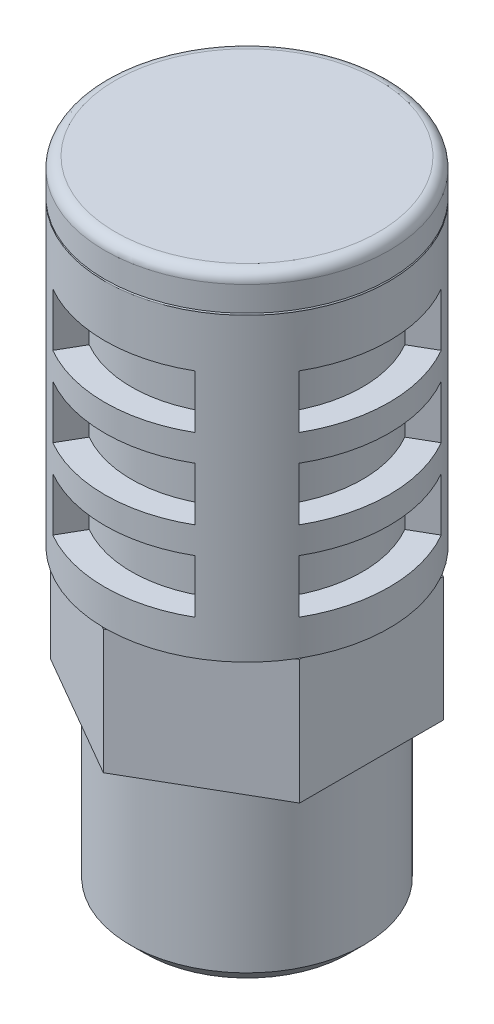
SolidWorks part; units mm, degrees
ref_plane "前视基准面" through (0, 0, 0) normal (0, 0, 1) x (1, 0, 0)
ref_plane "上视基准面" through (0, 0, 0) normal (0, 1, 0) x (1, 0, 0)
ref_plane "右视基准面" through (0, 0, 0) normal (1, 0, 0) x (0, 0, -1)
sketch "草图1" plane through (0, 0, 0) normal (0, 0, 1) x (1, 0, 0)
  line L0 (0, 36) -> (7.4, 36)
  line L1 (8, 35.4) -> (8, 34)
  line L2 (8, 34) -> (7.9, 34)
  line L3 (8, 33.9) -> (8, 17)
  line L4 (8, 17) -> (8.0829, 17)
  line L5 (8.0829, 17) -> (8.0829, 10)
  line L6 (8.0829, 10) -> (6.5785, 10)
  line L7 (6.5785, 10) -> (6.5785, 0.856)
  line L8 (6.5785, 0.856) -> (5.7225, 0)
  line L9 (5.7225, 0) -> (3.2893, 0)
  line L10 (3.2893, 0) -> (3.2893, 31)
  line L11 (3.2893, 31) -> (0, 32.899)
  line L12 (0, 32.899) -> (0, 36)
  line L13 (0, 0) -> (0, 36) construction
  arc A0 (7.4, 36) -> (8, 35.4) centre (7.4, 35.4) cw
  arc A1 (7.9, 34) -> (8, 33.9) centre (7.9, 33.9) cw
revolve "旋转1" add sketch "草图1" angle 360 about L13
sketch "草图2" plane through (0, 0, 0) normal (0, 0, 1) x (1, 0, 0)
  line L0 (6.5, 28) -> (8, 28)
  line L1 (8, 28) -> (8, 26.5)
  line L2 (8, 26.5) -> (6.5, 26.5)
  line L3 (6.5, 26.5) -> (6.5, 23.5)
  line L4 (6.5, 23.5) -> (8, 23.5)
  line L5 (8, 23.5) -> (8, 22)
  line L6 (8, 22) -> (6.5, 22)
  line L7 (6.5, 22) -> (6.5, 19)
  line L8 (6.5, 19) -> (16, 19)
  line L9 (16, 19) -> (16, 31)
  line L10 (16, 31) -> (6.5, 31)
  line L11 (6.5, 31) -> (6.5, 28)
  line L12 (0, 19) -> (0, 31) construction
revolve "切除-旋转1" cut sketch "草图2" angle 30 about L12
sketch "草图3" plane through (0, 0, 0) normal (0, 0, 1) x (1, 0, 0)
  line L0 (-16, 31) -> (-16, 19)
  line L1 (-16, 19) -> (-6.5, 19)
  line L2 (-6.5, 19) -> (-6.5, 22)
  line L3 (-6.5, 22) -> (-8, 22)
  line L4 (-8, 22) -> (-8, 23.5)
  line L5 (-8, 23.5) -> (-6.5, 23.5)
  line L6 (-6.5, 23.5) -> (-6.5, 26.5)
  line L7 (-6.5, 26.5) -> (-8, 26.5)
  line L8 (-8, 26.5) -> (-8, 28)
  line L9 (-8, 28) -> (-6.5, 28)
  line L10 (-6.5, 28) -> (-6.5, 31)
  line L11 (-6.5, 31) -> (-16, 31)
  line L12 (0, 31) -> (0, 19) construction
revolve "切除-旋转2" cut sketch "草图3" angle 30 about L12
sketch "草图4" plane through (0, 0, 0) normal (1, 0, 0) x (0, 0, -1)
  line L0 (6.5, 28) -> (8, 28)
  line L1 (8, 28) -> (8, 26.5)
  line L2 (8, 26.5) -> (6.5, 26.5)
  line L3 (6.5, 26.5) -> (6.5, 23.5)
  line L4 (6.5, 23.5) -> (8, 23.5)
  line L5 (8, 23.5) -> (8, 22)
  line L6 (8, 22) -> (6.5, 22)
  line L7 (6.5, 22) -> (6.5, 19)
  line L8 (6.5, 19) -> (16, 19)
  line L9 (16, 19) -> (16, 31)
  line L10 (16, 31) -> (6.5, 31)
  line L11 (6.5, 31) -> (6.5, 28)
  line L12 (0, 19) -> (0, 31) construction
revolve "切除-旋转3" cut sketch "草图4" angle 30 about L12
sketch "草图5" plane through (0, 0, 0) normal (1, 0, 0) x (0, 0, -1)
  line L0 (-16, 31) -> (-16, 19)
  line L1 (-16, 19) -> (-6.5, 19)
  line L2 (-6.5, 19) -> (-6.5, 22)
  line L3 (-6.5, 22) -> (-8, 22)
  line L4 (-8, 22) -> (-8, 23.5)
  line L5 (-8, 23.5) -> (-6.5, 23.5)
  line L6 (-6.5, 23.5) -> (-6.5, 26.5)
  line L7 (-6.5, 26.5) -> (-8, 26.5)
  line L8 (-8, 26.5) -> (-8, 28)
  line L9 (-8, 28) -> (-6.5, 28)
  line L10 (-6.5, 28) -> (-6.5, 31)
  line L11 (-6.5, 31) -> (-16, 31)
  line L12 (0, 31) -> (0, 19) construction
revolve "切除-旋转4" cut sketch "草图5" angle 30 about L12
ref_plane "基准面1" through (0, 10, 0) normal (0, 1, 0) x (1, 0, 0)
sketch "草图6" plane through (0, 10, 0) normal (0, 1, 0) x (1, 0, 0)
  line L0 (-7, -4.0415) -> (0, -8.0829)
  line L1 (0, -8.0829) -> (7, -4.0415)
  line L2 (7, -4.0415) -> (7, 4.0415)
  line L3 (7, 4.0415) -> (0, 8.0829)
  line L4 (0, 8.0829) -> (-7, 4.0415)
  line L5 (-7, 4.0415) -> (-7, -4.0415)
  circle A0 centre (0, 0) radius 14
extrude "切除-拉伸1" cut sketch "草图6" along normal blind 7
